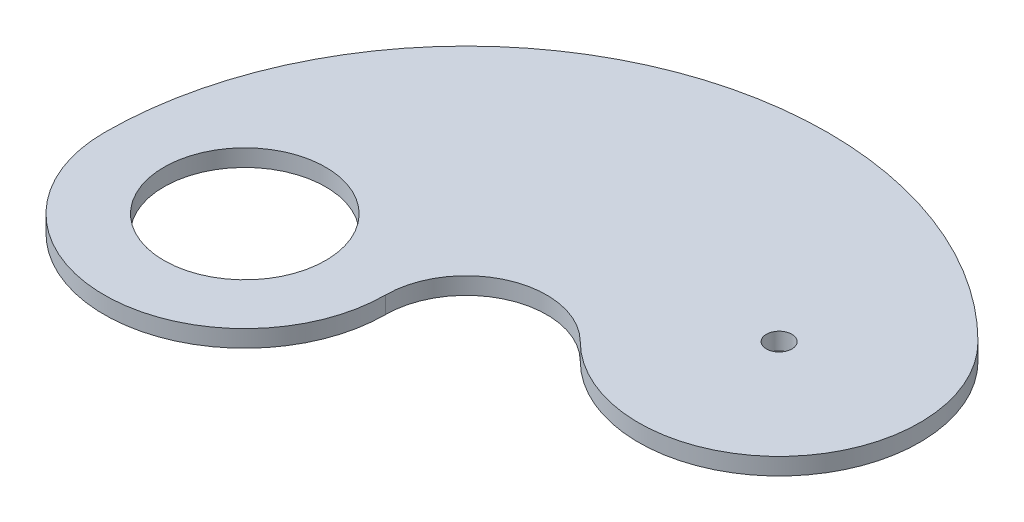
SolidWorks part; units mm, degrees
ref_plane "Front Plane" through (0, 0, 0) normal (0, 0, 1) x (1, 0, 0)
ref_plane "Top Plane" through (0, 0, 0) normal (0, 1, 0) x (1, 0, 0)
ref_plane "Right Plane" through (0, 0, 0) normal (1, 0, 0) x (0, 0, -1)
sketch "Sketch1" plane through (0, 0, 0) normal (0, 1, 0) x (1, 0, 0)
  circle A0 centre (0, 0) radius 135
  dimension "D1" = 270
extrude "Boss-Extrude1" add sketch "Sketch1" along normal blind 6.35
sketch "Sketch2" plane through (0, 6.35, 0) normal (0, 1, 0) x (1, 0, 0)
  line L0 (0, 0) -> (-82.55, 0) construction
  line L1 (0, 0) -> (95.4594, 95.4594) construction
  line L2 (0, 0) -> (0, 135) construction
  arc A0 (-135, 0) -> (-30.1, 0) centre (-82.55, 0) ccw
  circle A1 centre (-82.55, 0) radius 30.1625
  circle A2 centre (0, 0) radius 135 construction
  arc A3 (95.4594, 95.4594) -> (-135, 0) centre (0, 0) ccw
  arc A4 (21.2839, 21.2839) -> (-30.1, 0) centre (0, 0) ccw
  arc A5 (21.2839, 21.2839) -> (95.4594, 95.4594) centre (58.3717, 58.3717) ccw
  dimension "D1" = 60.325
  dimension "D2" = 82.55
  dimension "D4" = 45
extrude "Cut-Extrude1" cut sketch "Sketch2" against normal through all contours A5 A4 A0 M1 | A1
sketch "Sketch3" plane through (0, 6.35, 0) normal (0, 1, 0) x (1, 0, 0)
  line L0 (0, 0) -> (0, 135) construction
  line L1 (0, 0) -> (95.4594, 95.4594) construction
  arc A0 (95.4594, 95.4594) -> (-135, 0) centre (0, 0) ccw construction
  circle A1 centre (58.3717, 58.3717) radius 4.7625
  dimension "D1" = 9.525
  dimension "D3" = 82.55
  dimension "D2" = 45
extrude "Cut-Extrude2" cut sketch "Sketch3" against normal through all
sketch "Sketch5" plane through (0, 6.35, 0) normal (0, 1, 0) x (1, 0, 0)
  line L0 (-62.4783, -48.4575) -> (78.4434, 9.9142)
  arc A0 (-135, 0) -> (-30.1, 0) centre (-82.55, 0) ccw construction
  arc A1 (21.2839, 21.2839) -> (-30.1, 0) centre (0, 0) ccw construction
  arc A2 (21.2839, 21.2839) -> (95.4594, 95.4594) centre (58.3717, 58.3717) ccw construction
  arc A3 (-62.4783, -48.4575) -> (-30.1, 0) centre (-82.55, 0) ccw
  arc A4 (21.2839, 21.2839) -> (-30.1, 0) centre (0, 0) ccw
  arc A5 (21.2839, 21.2839) -> (78.4434, 9.9142) centre (58.3717, 58.3717) ccw
extrude "Boss-Extrude2" [suppressed] add sketch "Sketch5" against normal up to surface (6.35 mm away)
